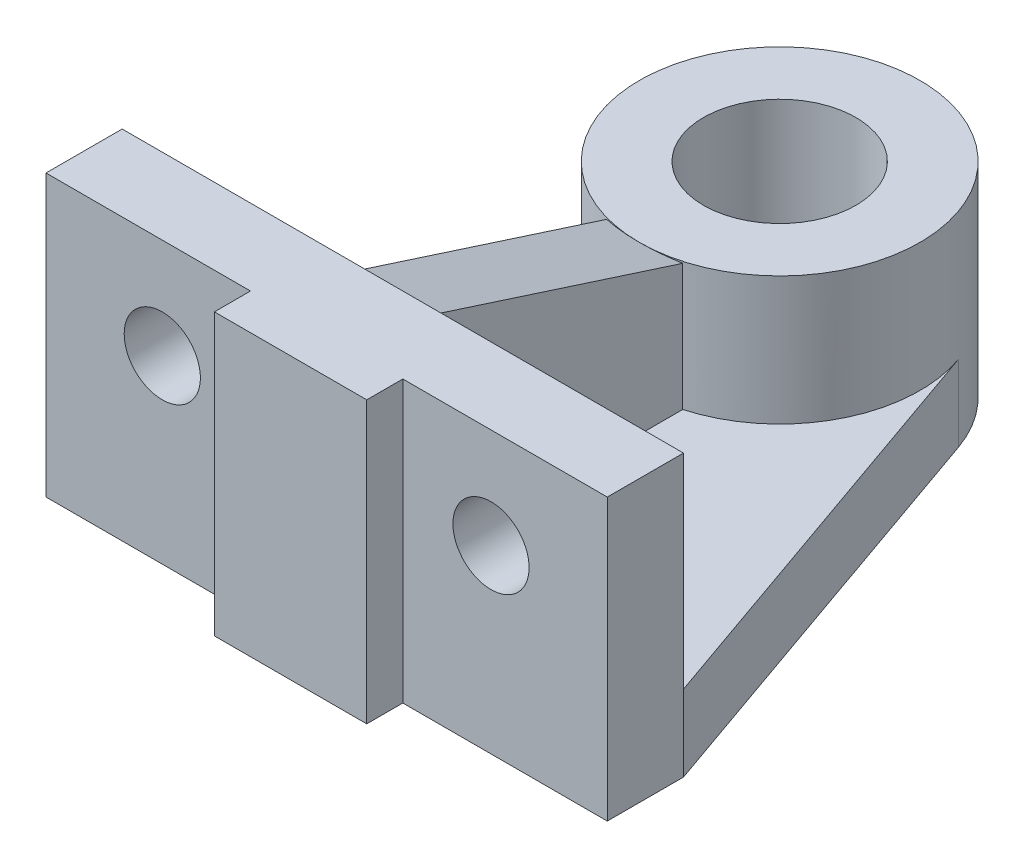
SolidWorks part; units mm, degrees
ref_plane "Front Plane" through (0, 0, 0) normal (0, 0, 1) x (1, 0, 0)
ref_plane "Top Plane" through (0, 0, 0) normal (0, 1, 0) x (1, 0, 0)
ref_plane "Right Plane" through (0, 0, 0) normal (1, 0, 0) x (0, 0, -1)
sketch "Sketch1" plane through (0, 0, 0) normal (0, 1, 0) x (1, 0, 0)
  line L0 (0, 0) -> (0, -113) construction
  line L1 (-70, -113) -> (70, -113)
  line L2 (70, -113) -> (70, -94)
  line L3 (70, -94) -> (33.0333, 11.5673)
  line L4 (-70, -113) -> (-70, -94)
  line L5 (-70, -94) -> (-33.0333, 11.5673)
  arc A0 (33.0333, 11.5673) -> (-33.0333, 11.5673) centre (0, 0) ccw
  circle A1 centre (0, 0) radius 19
  point P7 (0, -113)
  dimension "D1" = 70
  dimension "D5" = 38
  dimension "D2" = 113
  dimension "D3" = 140
  dimension "D4" = 19
extrude "Boss-Extrude1" add sketch "Sketch1" along normal blind 19
sketch "Sketch2" plane through (0, 19, 0) normal (0, 1, 0) x (1, 0, 0)
  circle A0 centre (0, 0) radius 19 construction
  circle A1 centre (0, 0) radius 19
  circle A2 centre (0, 0) radius 35
  dimension "D1" = 70
extrude "Boss-Extrude2" add sketch "Sketch2" along normal blind 32
sketch "Sketch3" plane through (0, 0, 113) normal (0, 0, 1) x (1, 0, 0)
  line L1 (-70, 19) -> (70, 19)
  line L2 (-70, 19) -> (-70, 70)
  line L3 (-70, 70) -> (70, 70)
  line L4 (70, 19) -> (70, 70)
  dimension "D1" = 140
  dimension "D2" = 51
extrude "Boss-Extrude3" add sketch "Sketch3" against normal blind 19
sketch "Sketch4" plane through (0, 70, 0) normal (0, 1, 0) x (1, 0, 0)
  line L0 (70, -113) -> (-70, -113) construction
  line L1 (19, -113) -> (-19, -113)
  line L2 (19, -113) -> (19, -122)
  line L3 (19, -122) -> (-19, -122)
  line L4 (-19, -113) -> (-19, -122)
  point P6 (0, -113)
  point P7 (0, -113)
  dimension "D1" = 9
  dimension "D2" = 38
extrude "Boss-Extrude4" add sketch "Sketch4" against normal up to surface (70 mm away)
sketch "Sketch5" plane through (0, 0, 94) normal (0, 0, -1) x (-1, 0, 0)
  line L0 (0, 0) -> (0, 45) construction
  circle A0 centre (-41, 45) radius 9.5
  circle A1 centre (41, 45) radius 9.5
  point P7 (0, 0)
  dimension "D1" = 19
  dimension "D2" = 45
  dimension "D3" = 41
  dimension "D4" = 41
extrude "Cut-Extrude1" cut sketch "Sketch5" against normal blind 19
sketch "Sketch6" plane through (0, 0, 0) normal (1, 0, 0) x (0, 0, -1)
  line L0 (-94, 19) -> (-94, 70)
  line L1 (-94, 70) -> (-35, 51)
  line L2 (-35, 51) -> (-35, 19) construction
  line L4 (-94, 19) -> (11.5673, 19) construction
  line L5 (-35, 19) -> (-94, 19)
  line L6 (-35, 51) -> (-19, 45.8475)
  line L7 (-19, 45.8475) -> (-19, 19)
  line L8 (11.5673, 19) -> (-94, 19) construction
  line L9 (-19, 19) -> (-35, 19)
  line L10 (-19, 51) -> (-19, 0) construction
extrude "Boss-Extrude8" add sketch "Sketch6" along normal mid plane 19
